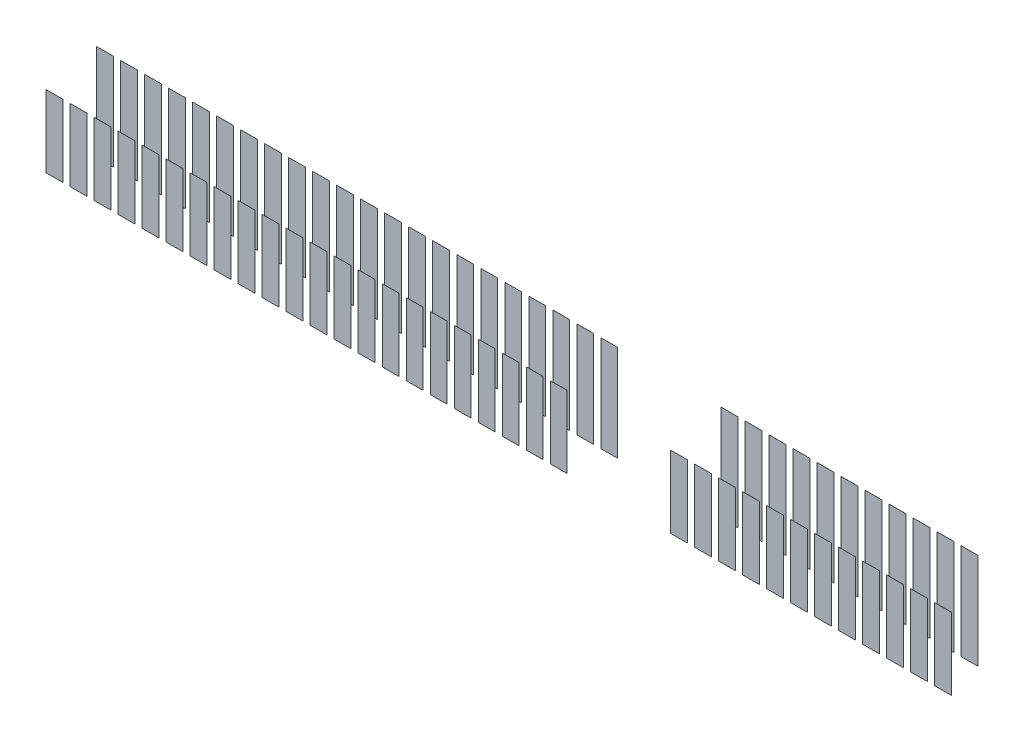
SolidWorks part; units mm, degrees
ref_plane "Front Plane" through (0, 0, 0) normal (0, 0, 1) x (1, 0, 0)
ref_plane "Top Plane" through (0, 0, 0) normal (0, 1, 0) x (1, 0, 0)
ref_plane "Right Plane" through (0, 0, 0) normal (1, 0, 0) x (0, 0, -1)
sketch "top" plane through (0, 0, 0) normal (0, 0, 1) x (1, 0, 0)
  line L0 (-9.9286, -5.2) -> (-9.925, -5.2)
  line L1 (11.003, -1.22) -> (11.011, -1.196)
  line L2 (11.011, 0.004) -> (11, 0)
  line L3 (-11, 0) -> (-11, -0.02)
  line L4 (11.003, -1.22) -> (10.4224, -1.22)
  line L5 (9.9224, -1.7204) -> (9.925, -5.2)
  line L6 (9.925, -5.2) -> (3.23, -5.2)
  line L7 (3.23, -5.2) -> (3.23, -2.3)
  line L8 (2.03, -2.3) -> (2.03, -5.2)
  line L9 (2.03, -5.2) -> (-9.925, -5.2)
  line L10 (-9.925, -5.2) -> (-9.9286, -5.2)
  line L11 (-9.9286, -5.2) -> (-9.926, -1.7204)
  line L12 (-10.426, -1.22) -> (-11.0066, -1.22)
  line L13 (-11.0066, -1.22) -> (-11, -1.22)
  line L14 (-11, -1.22) -> (-11, -0.02)
  line L15 (-11, -0.02) -> (-11, 0)
  line L16 (-11, 0) -> (11, 0)
  line L17 (11, 0) -> (11.011, 0.004)
  line L18 (11.011, 0.004) -> (11.011, -1.196)
  line L19 (-1.905, 0) -> (1.905, 0)
  line L20 (0, -1.905) -> (0, 1.905)
  line L21 (-1.905, 0) -> (1.905, 0)
  line L22 (0, -1.905) -> (0, 1.905)
  line L23 (-1, -1) -> (-1, 1)
  line L24 (-1, 1) -> (1, 1)
  line L25 (1, 1) -> (1, -1)
  line L26 (1, -1) -> (-1, -1)
  line L27 (9.075, -4.7) -> (9.425, -4.7)
  line L28 (9.425, -4.7) -> (9.425, -3.2)
  line L29 (9.425, -3.2) -> (9.075, -3.2)
  line L30 (9.075, -3.2) -> (9.075, -4.7)
  line L31 (8.575, -4.7) -> (8.925, -4.7)
  line L32 (8.925, -4.7) -> (8.925, -3.2)
  line L33 (8.925, -3.2) -> (8.575, -3.2)
  line L34 (8.575, -3.2) -> (8.575, -4.7)
  line L35 (8.075, -4.7) -> (8.425, -4.7)
  line L36 (8.425, -4.7) -> (8.425, -3.2)
  line L37 (8.425, -3.2) -> (8.075, -3.2)
  line L38 (8.075, -3.2) -> (8.075, -4.7)
  line L39 (7.575, -4.7) -> (7.925, -4.7)
  line L40 (7.925, -4.7) -> (7.925, -3.2)
  line L41 (7.925, -3.2) -> (7.575, -3.2)
  line L42 (7.575, -3.2) -> (7.575, -4.7)
  line L43 (7.075, -4.7) -> (7.425, -4.7)
  line L44 (7.425, -4.7) -> (7.425, -3.2)
  line L45 (7.425, -3.2) -> (7.075, -3.2)
  line L46 (7.075, -3.2) -> (7.075, -4.7)
  line L47 (6.575, -4.7) -> (6.925, -4.7)
  line L48 (6.925, -4.7) -> (6.925, -3.2)
  line L49 (6.925, -3.2) -> (6.575, -3.2)
  line L50 (6.575, -3.2) -> (6.575, -4.7)
  line L51 (6.075, -4.7) -> (6.425, -4.7)
  line L52 (6.425, -4.7) -> (6.425, -3.2)
  line L53 (6.425, -3.2) -> (6.075, -3.2)
  line L54 (6.075, -3.2) -> (6.075, -4.7)
  line L55 (5.575, -4.7) -> (5.925, -4.7)
  line L56 (5.925, -4.7) -> (5.925, -3.2)
  line L57 (5.925, -3.2) -> (5.575, -3.2)
  line L58 (5.575, -3.2) -> (5.575, -4.7)
  line L59 (5.075, -4.7) -> (5.425, -4.7)
  line L60 (5.425, -4.7) -> (5.425, -3.2)
  line L61 (5.425, -3.2) -> (5.075, -3.2)
  line L62 (5.075, -3.2) -> (5.075, -4.7)
  line L63 (4.575, -4.7) -> (4.925, -4.7)
  line L64 (4.925, -4.7) -> (4.925, -3.2)
  line L65 (4.925, -3.2) -> (4.575, -3.2)
  line L66 (4.575, -3.2) -> (4.575, -4.7)
  line L67 (4.075, -4.7) -> (4.425, -4.7)
  line L68 (4.425, -4.7) -> (4.425, -3.2)
  line L69 (4.425, -3.2) -> (4.075, -3.2)
  line L70 (4.075, -3.2) -> (4.075, -4.7)
  line L71 (3.575, -4.7) -> (3.925, -4.7)
  line L72 (3.925, -4.7) -> (3.925, -3.2)
  line L73 (3.925, -3.2) -> (3.575, -3.2)
  line L74 (3.575, -3.2) -> (3.575, -4.7)
  line L75 (1.075, -4.7) -> (1.425, -4.7)
  line L76 (1.425, -4.7) -> (1.425, -3.2)
  line L77 (1.425, -3.2) -> (1.075, -3.2)
  line L78 (1.075, -3.2) -> (1.075, -4.7)
  line L79 (0.575, -4.7) -> (0.925, -4.7)
  line L80 (0.925, -4.7) -> (0.925, -3.2)
  line L81 (0.925, -3.2) -> (0.575, -3.2)
  line L82 (0.575, -3.2) -> (0.575, -4.7)
  line L83 (0.075, -4.7) -> (0.425, -4.7)
  line L84 (0.425, -4.7) -> (0.425, -3.2)
  line L85 (0.425, -3.2) -> (0.075, -3.2)
  line L86 (0.075, -3.2) -> (0.075, -4.7)
  line L87 (-0.425, -4.7) -> (-0.075, -4.7)
  line L88 (-0.075, -4.7) -> (-0.075, -3.2)
  line L89 (-0.075, -3.2) -> (-0.425, -3.2)
  line L90 (-0.425, -3.2) -> (-0.425, -4.7)
  line L91 (-0.925, -4.7) -> (-0.575, -4.7)
  line L92 (-0.575, -4.7) -> (-0.575, -3.2)
  line L93 (-0.575, -3.2) -> (-0.925, -3.2)
  line L94 (-0.925, -3.2) -> (-0.925, -4.7)
  line L95 (-1.425, -4.7) -> (-1.075, -4.7)
  line L96 (-1.075, -4.7) -> (-1.075, -3.2)
  line L97 (-1.075, -3.2) -> (-1.425, -3.2)
  line L98 (-1.425, -3.2) -> (-1.425, -4.7)
  line L99 (-1.925, -4.7) -> (-1.575, -4.7)
  line L100 (-1.575, -4.7) -> (-1.575, -3.2)
  line L101 (-1.575, -3.2) -> (-1.925, -3.2)
  line L102 (-1.925, -3.2) -> (-1.925, -4.7)
  line L103 (-2.425, -4.7) -> (-2.075, -4.7)
  line L104 (-2.075, -4.7) -> (-2.075, -3.2)
  line L105 (-2.075, -3.2) -> (-2.425, -3.2)
  line L106 (-2.425, -3.2) -> (-2.425, -4.7)
  line L107 (-2.925, -4.7) -> (-2.575, -4.7)
  line L108 (-2.575, -4.7) -> (-2.575, -3.2)
  line L109 (-2.575, -3.2) -> (-2.925, -3.2)
  line L110 (-2.925, -3.2) -> (-2.925, -4.7)
  line L111 (-3.425, -4.7) -> (-3.075, -4.7)
  line L112 (-3.075, -4.7) -> (-3.075, -3.2)
  line L113 (-3.075, -3.2) -> (-3.425, -3.2)
  line L114 (-3.425, -3.2) -> (-3.425, -4.7)
  line L115 (-3.925, -4.7) -> (-3.575, -4.7)
  line L116 (-3.575, -4.7) -> (-3.575, -3.2)
  line L117 (-3.575, -3.2) -> (-3.925, -3.2)
  line L118 (-3.925, -3.2) -> (-3.925, -4.7)
  line L119 (-4.425, -4.7) -> (-4.075, -4.7)
  line L120 (-4.075, -4.7) -> (-4.075, -3.2)
  line L121 (-4.075, -3.2) -> (-4.425, -3.2)
  line L122 (-4.425, -3.2) -> (-4.425, -4.7)
  line L123 (-4.925, -4.7) -> (-4.575, -4.7)
  line L124 (-4.575, -4.7) -> (-4.575, -3.2)
  line L125 (-4.575, -3.2) -> (-4.925, -3.2)
  line L126 (-4.925, -3.2) -> (-4.925, -4.7)
  line L127 (-5.425, -4.7) -> (-5.075, -4.7)
  line L128 (-5.075, -4.7) -> (-5.075, -3.2)
  line L129 (-5.075, -3.2) -> (-5.425, -3.2)
  line L130 (-5.425, -3.2) -> (-5.425, -4.7)
  line L131 (-5.925, -4.7) -> (-5.575, -4.7)
  line L132 (-5.575, -4.7) -> (-5.575, -3.2)
  line L133 (-5.575, -3.2) -> (-5.925, -3.2)
  line L134 (-5.925, -3.2) -> (-5.925, -4.7)
  line L135 (-6.425, -4.7) -> (-6.075, -4.7)
  line L136 (-6.075, -4.7) -> (-6.075, -3.2)
  line L137 (-6.075, -3.2) -> (-6.425, -3.2)
  line L138 (-6.425, -3.2) -> (-6.425, -4.7)
  line L139 (-6.925, -4.7) -> (-6.575, -4.7)
  line L140 (-6.575, -4.7) -> (-6.575, -3.2)
  line L141 (-6.575, -3.2) -> (-6.925, -3.2)
  line L142 (-6.925, -3.2) -> (-6.925, -4.7)
  line L143 (-7.425, -4.7) -> (-7.075, -4.7)
  line L144 (-7.075, -4.7) -> (-7.075, -3.2)
  line L145 (-7.075, -3.2) -> (-7.425, -3.2)
  line L146 (-7.425, -3.2) -> (-7.425, -4.7)
  line L147 (-7.925, -4.7) -> (-7.575, -4.7)
  line L148 (-7.575, -4.7) -> (-7.575, -3.2)
  line L149 (-7.575, -3.2) -> (-7.925, -3.2)
  line L150 (-7.925, -3.2) -> (-7.925, -4.7)
  line L151 (-8.425, -4.7) -> (-8.075, -4.7)
  line L152 (-8.075, -4.7) -> (-8.075, -3.2)
  line L153 (-8.075, -3.2) -> (-8.425, -3.2)
  line L154 (-8.425, -3.2) -> (-8.425, -4.7)
  line L155 (-8.925, -4.7) -> (-8.575, -4.7)
  line L156 (-8.575, -4.7) -> (-8.575, -3.2)
  line L157 (-8.575, -3.2) -> (-8.925, -3.2)
  line L158 (-8.925, -3.2) -> (-8.925, -4.7)
  line L159 (-9.425, -4.7) -> (-9.075, -4.7)
  line L160 (-9.075, -4.7) -> (-9.075, -3.2)
  line L161 (-9.075, -3.2) -> (-9.425, -3.2)
  line L162 (-9.425, -3.2) -> (-9.425, -4.7)
  line L163 (11.003, -1.22) -> (10.422, -1.22)
  line L164 (9.922, -1.72) -> (9.925, -5.2)
  line L165 (9.925, -5.2) -> (3.23, -5.2)
  line L166 (3.23, -5.2) -> (3.23, -2.3)
  line L167 (2.03, -2.3) -> (2.03, -5.2)
  line L168 (2.03, -5.2) -> (-9.929, -5.2)
  line L169 (-9.929, -5.2) -> (-9.926, -1.72)
  line L170 (-10.426, -1.22) -> (-11.007, -1.22)
  line L171 (-11.007, -1.22) -> (-11, -1.22)
  line L172 (-11, -1.22) -> (-11, 0)
  line L173 (-11, 0) -> (11, 0)
  line L174 (11, 0) -> (11.011, 0.004)
  line L175 (11.011, 0.004) -> (11.011, -1.196)
  arc A0 (10.4224, -1.22) -> (9.9224, -1.7204) centre (10.4224, -1.72) ccw
  arc A1 (3.23, -2.3) -> (2.03, -2.3) centre (2.63, -2.3) ccw
  arc A2 (-9.926, -1.7204) -> (-10.426, -1.22) centre (-10.426, -1.72) ccw
  circle A3 centre (0, 0) radius 1
  arc A4 (10.422, -1.22) -> (9.922, -1.72) centre (10.422, -1.72) ccw
  arc A5 (3.23, -2.3) -> (2.03, -2.3) centre (2.63, -2.3) ccw
  arc A6 (-9.926, -1.72) -> (-10.426, -1.22) centre (-10.426, -1.72) ccw
  text T0 "B" font "ARIAL" height 1
  text T1 "D" font "ARIAL" height 1
sketch "bottom" plane through (0, 0, 0) normal (0, 0, 1) x (1, 0, 0)
  line L0 (-9.9286, -5.2) -> (-9.925, -5.2)
  line L1 (11.003, -1.22) -> (11.011, -1.196)
  line L2 (11.011, 0.004) -> (11, 0)
  line L3 (-11, 0) -> (-11, -0.02)
  line L4 (11.003, -1.22) -> (10.4224, -1.22)
  line L5 (9.9224, -1.7204) -> (9.925, -5.2)
  line L6 (9.925, -5.2) -> (3.23, -5.2)
  line L7 (3.23, -5.2) -> (3.23, -2.3)
  line L8 (2.03, -2.3) -> (2.03, -5.2)
  line L9 (2.03, -5.2) -> (-9.925, -5.2)
  line L10 (-9.925, -5.2) -> (-9.9286, -5.2)
  line L11 (-9.9286, -5.2) -> (-9.926, -1.7204)
  line L12 (-10.426, -1.22) -> (-11.0066, -1.22)
  line L13 (-11.0066, -1.22) -> (-11, -1.22)
  line L14 (-11, -1.22) -> (-11, -0.02)
  line L15 (-11, -0.02) -> (-11, 0)
  line L16 (-11, 0) -> (11, 0)
  line L17 (11, 0) -> (11.011, 0.004)
  line L18 (11.011, 0.004) -> (11.011, -1.196)
  line L19 (-1.905, 0) -> (1.905, 0)
  line L20 (0, -1.905) -> (0, 1.905)
  line L21 (-1.905, 0) -> (1.905, 0)
  line L22 (0, -1.905) -> (0, 1.905)
  line L23 (-1, -1) -> (-1, 1)
  line L24 (-1, 1) -> (1, 1)
  line L25 (1, 1) -> (1, -1)
  line L26 (1, -1) -> (-1, -1)
  line L27 (8.825, -4.7) -> (9.175, -4.7)
  line L28 (9.175, -4.7) -> (9.175, -2.7)
  line L29 (9.175, -2.7) -> (8.825, -2.7)
  line L30 (8.825, -2.7) -> (8.825, -4.7)
  line L31 (8.325, -4.7) -> (8.675, -4.7)
  line L32 (8.675, -4.7) -> (8.675, -2.7)
  line L33 (8.675, -2.7) -> (8.325, -2.7)
  line L34 (8.325, -2.7) -> (8.325, -4.7)
  line L35 (7.825, -4.7) -> (8.175, -4.7)
  line L36 (8.175, -4.7) -> (8.175, -2.7)
  line L37 (8.175, -2.7) -> (7.825, -2.7)
  line L38 (7.825, -2.7) -> (7.825, -4.7)
  line L39 (7.325, -4.7) -> (7.675, -4.7)
  line L40 (7.675, -4.7) -> (7.675, -2.7)
  line L41 (7.675, -2.7) -> (7.325, -2.7)
  line L42 (7.325, -2.7) -> (7.325, -4.7)
  line L43 (6.825, -4.7) -> (7.175, -4.7)
  line L44 (7.175, -4.7) -> (7.175, -2.7)
  line L45 (7.175, -2.7) -> (6.825, -2.7)
  line L46 (6.825, -2.7) -> (6.825, -4.7)
  line L47 (6.325, -4.7) -> (6.675, -4.7)
  line L48 (6.675, -4.7) -> (6.675, -2.7)
  line L49 (6.675, -2.7) -> (6.325, -2.7)
  line L50 (6.325, -2.7) -> (6.325, -4.7)
  line L51 (5.825, -4.7) -> (6.175, -4.7)
  line L52 (6.175, -4.7) -> (6.175, -2.7)
  line L53 (6.175, -2.7) -> (5.825, -2.7)
  line L54 (5.825, -2.7) -> (5.825, -4.7)
  line L55 (5.325, -4.7) -> (5.675, -4.7)
  line L56 (5.675, -4.7) -> (5.675, -2.7)
  line L57 (5.675, -2.7) -> (5.325, -2.7)
  line L58 (5.325, -2.7) -> (5.325, -4.7)
  line L59 (4.825, -4.7) -> (5.175, -4.7)
  line L60 (5.175, -4.7) -> (5.175, -2.7)
  line L61 (5.175, -2.7) -> (4.825, -2.7)
  line L62 (4.825, -2.7) -> (4.825, -4.7)
  line L63 (4.325, -4.7) -> (4.675, -4.7)
  line L64 (4.675, -4.7) -> (4.675, -2.7)
  line L65 (4.675, -2.7) -> (4.325, -2.7)
  line L66 (4.325, -2.7) -> (4.325, -4.7)
  line L67 (3.825, -4.7) -> (4.175, -4.7)
  line L68 (4.175, -4.7) -> (4.175, -2.7)
  line L69 (4.175, -2.7) -> (3.825, -2.7)
  line L70 (3.825, -2.7) -> (3.825, -4.7)
  line L71 (1.325, -4.7) -> (1.675, -4.7)
  line L72 (1.675, -4.7) -> (1.675, -2.7)
  line L73 (1.675, -2.7) -> (1.325, -2.7)
  line L74 (1.325, -2.7) -> (1.325, -4.7)
  line L75 (0.825, -4.7) -> (1.175, -4.7)
  line L76 (1.175, -4.7) -> (1.175, -2.7)
  line L77 (1.175, -2.7) -> (0.825, -2.7)
  line L78 (0.825, -2.7) -> (0.825, -4.7)
  line L79 (0.325, -4.7) -> (0.675, -4.7)
  line L80 (0.675, -4.7) -> (0.675, -2.7)
  line L81 (0.675, -2.7) -> (0.325, -2.7)
  line L82 (0.325, -2.7) -> (0.325, -4.7)
  line L83 (-0.175, -4.7) -> (0.175, -4.7)
  line L84 (0.175, -4.7) -> (0.175, -2.7)
  line L85 (0.175, -2.7) -> (-0.175, -2.7)
  line L86 (-0.175, -2.7) -> (-0.175, -4.7)
  line L87 (-0.675, -4.7) -> (-0.325, -4.7)
  line L88 (-0.325, -4.7) -> (-0.325, -2.7)
  line L89 (-0.325, -2.7) -> (-0.675, -2.7)
  line L90 (-0.675, -2.7) -> (-0.675, -4.7)
  line L91 (-1.175, -4.7) -> (-0.825, -4.7)
  line L92 (-0.825, -4.7) -> (-0.825, -2.7)
  line L93 (-0.825, -2.7) -> (-1.175, -2.7)
  line L94 (-1.175, -2.7) -> (-1.175, -4.7)
  line L95 (-1.675, -4.7) -> (-1.325, -4.7)
  line L96 (-1.325, -4.7) -> (-1.325, -2.7)
  line L97 (-1.325, -2.7) -> (-1.675, -2.7)
  line L98 (-1.675, -2.7) -> (-1.675, -4.7)
  line L99 (-2.175, -4.7) -> (-1.825, -4.7)
  line L100 (-1.825, -4.7) -> (-1.825, -2.7)
  line L101 (-1.825, -2.7) -> (-2.175, -2.7)
  line L102 (-2.175, -2.7) -> (-2.175, -4.7)
  line L103 (-2.675, -4.7) -> (-2.325, -4.7)
  line L104 (-2.325, -4.7) -> (-2.325, -2.7)
  line L105 (-2.325, -2.7) -> (-2.675, -2.7)
  line L106 (-2.675, -2.7) -> (-2.675, -4.7)
  line L107 (-3.175, -4.7) -> (-2.825, -4.7)
  line L108 (-2.825, -4.7) -> (-2.825, -2.7)
  line L109 (-2.825, -2.7) -> (-3.175, -2.7)
  line L110 (-3.175, -2.7) -> (-3.175, -4.7)
  line L111 (-3.675, -4.7) -> (-3.325, -4.7)
  line L112 (-3.325, -4.7) -> (-3.325, -2.7)
  line L113 (-3.325, -2.7) -> (-3.675, -2.7)
  line L114 (-3.675, -2.7) -> (-3.675, -4.7)
  line L115 (-4.175, -4.7) -> (-3.825, -4.7)
  line L116 (-3.825, -4.7) -> (-3.825, -2.7)
  line L117 (-3.825, -2.7) -> (-4.175, -2.7)
  line L118 (-4.175, -2.7) -> (-4.175, -4.7)
  line L119 (-4.675, -4.7) -> (-4.325, -4.7)
  line L120 (-4.325, -4.7) -> (-4.325, -2.7)
  line L121 (-4.325, -2.7) -> (-4.675, -2.7)
  line L122 (-4.675, -2.7) -> (-4.675, -4.7)
  line L123 (-5.175, -4.7) -> (-4.825, -4.7)
  line L124 (-4.825, -4.7) -> (-4.825, -2.7)
  line L125 (-4.825, -2.7) -> (-5.175, -2.7)
  line L126 (-5.175, -2.7) -> (-5.175, -4.7)
  line L127 (-5.675, -4.7) -> (-5.325, -4.7)
  line L128 (-5.325, -4.7) -> (-5.325, -2.7)
  line L129 (-5.325, -2.7) -> (-5.675, -2.7)
  line L130 (-5.675, -2.7) -> (-5.675, -4.7)
  line L131 (-6.175, -4.7) -> (-5.825, -4.7)
  line L132 (-5.825, -4.7) -> (-5.825, -2.7)
  line L133 (-5.825, -2.7) -> (-6.175, -2.7)
  line L134 (-6.175, -2.7) -> (-6.175, -4.7)
  line L135 (-6.675, -4.7) -> (-6.325, -4.7)
  line L136 (-6.325, -4.7) -> (-6.325, -2.7)
  line L137 (-6.325, -2.7) -> (-6.675, -2.7)
  line L138 (-6.675, -2.7) -> (-6.675, -4.7)
  line L139 (-7.175, -4.7) -> (-6.825, -4.7)
  line L140 (-6.825, -4.7) -> (-6.825, -2.7)
  line L141 (-6.825, -2.7) -> (-7.175, -2.7)
  line L142 (-7.175, -2.7) -> (-7.175, -4.7)
  line L143 (-7.675, -4.7) -> (-7.325, -4.7)
  line L144 (-7.325, -4.7) -> (-7.325, -2.7)
  line L145 (-7.325, -2.7) -> (-7.675, -2.7)
  line L146 (-7.675, -2.7) -> (-7.675, -4.7)
  line L147 (-8.175, -4.7) -> (-7.825, -4.7)
  line L148 (-7.825, -4.7) -> (-7.825, -2.7)
  line L149 (-7.825, -2.7) -> (-8.175, -2.7)
  line L150 (-8.175, -2.7) -> (-8.175, -4.7)
  line L151 (-8.675, -4.7) -> (-8.325, -4.7)
  line L152 (-8.325, -4.7) -> (-8.325, -2.7)
  line L153 (-8.325, -2.7) -> (-8.675, -2.7)
  line L154 (-8.675, -2.7) -> (-8.675, -4.7)
  line L155 (-9.175, -4.7) -> (-8.825, -4.7)
  line L156 (-8.825, -4.7) -> (-8.825, -2.7)
  line L157 (-8.825, -2.7) -> (-9.175, -2.7)
  line L158 (-9.175, -2.7) -> (-9.175, -4.7)
  line L159 (11.003, -1.22) -> (10.422, -1.22)
  line L160 (9.922, -1.72) -> (9.925, -5.2)
  line L161 (9.925, -5.2) -> (3.23, -5.2)
  line L162 (3.23, -5.2) -> (3.23, -2.3)
  line L163 (2.03, -2.3) -> (2.03, -5.2)
  line L164 (2.03, -5.2) -> (-9.929, -5.2)
  line L165 (-9.929, -5.2) -> (-9.926, -1.72)
  line L166 (-10.426, -1.22) -> (-11.007, -1.22)
  line L167 (-11.007, -1.22) -> (-11, -1.22)
  line L168 (-11, -1.22) -> (-11, 0)
  line L169 (-11, 0) -> (11, 0)
  line L170 (11, 0) -> (11.011, 0.004)
  line L171 (11.011, 0.004) -> (11.011, -1.196)
  arc A0 (10.4224, -1.22) -> (9.9224, -1.7204) centre (10.4224, -1.72) ccw
  arc A1 (3.23, -2.3) -> (2.03, -2.3) centre (2.63, -2.3) ccw
  arc A2 (-9.926, -1.7204) -> (-10.426, -1.22) centre (-10.426, -1.72) ccw
  circle A3 centre (0, 0) radius 1
  arc A4 (10.422, -1.22) -> (9.922, -1.72) centre (10.422, -1.72) ccw
  arc A5 (3.23, -2.3) -> (2.03, -2.3) centre (2.63, -2.3) ccw
  arc A6 (-9.926, -1.72) -> (-10.426, -1.22) centre (-10.426, -1.72) ccw
  text T0 "B" font "ARIAL" height 1
  text T1 "D" font "ARIAL" height 1
ref_plane "bottom-Plane" through (0, 0, -0.8) normal (0, 0, 1) x (1, 0, 0)
extrude "Boss-Extrude1-TOP" add sketch "top" along normal blind 0.001 contours L161 L162 L159 L160 | L153 L154 L151 L152 | L149 L150 L147 L148 | L141 L142 L139 L140 | L133 L134 L131 L132 | L129 L130 L127 L128 | L125 L126 L123 L124 | L121 L122 L119 L120 | L117 L118 L115 L116 | L113 L114 L111 L112 | L109 L110 L107 L108 | L97 L98 L95 L96 | L93 L94 L91 L92 | L89 L90 L87 L88 | L85 L86 L83 L84 | L81 L82 L79 L80 | L73 L74 L71 L72 | L69 L70 L67 L68 | L65 L66 L63 L64 | L61 L62 L59 L60 | L57 L58 L55 L56 | L53 L54 L51 L52 | L49 L50 L47 L48 | L45 L46 L43 L44 | L41 L42 L39 L40 | L37 L38 L35 L36 | L33 L34 L31 L32 | L158 L155 L156 L157 | L146 L143 L144 L145 | L138 L135 L136 L137 | L106 L103 L104 L105 | L102 L99 L100 L101 | L78 L75 L76 L77 | L28 L29 L30 L27
extrude "Boss-Extrude2-BOTTOM" add sketch "bottom" against normal blind 0.001 from surface at -0.8 separate body contours L157 L158 L155 L156 | L153 L154 L151 L152 | L149 L150 L147 L148 | L145 L146 L143 L144 | L141 L142 L139 L140 | L137 L138 L135 L136 | L133 L134 L131 L132 | L129 L130 L127 L128 | L125 L126 L123 L124 | L121 L122 L119 L120 | L117 L118 L115 L116 | L113 L114 L111 L112 | L109 L110 L107 L108 | L105 L106 L103 L104 | L101 L102 L99 L100 | L97 L98 L95 L96 | L93 L94 L91 L92 | L89 L90 L87 L88 | L85 L86 L83 L84 | L81 L82 L79 L80 | L77 L78 L75 L76 | L73 L74 L71 L72 | L69 L70 L67 L68 | L65 L66 L63 L64 | L61 L62 L59 L60 | L57 L58 L55 L56 | L53 L54 L51 L52 | L49 L50 L47 L48 | L45 L46 L43 L44 | L41 L42 L39 L40 | L37 L38 L35 L36 | L33 L34 L31 L32 | L29 L30 L27 L28
